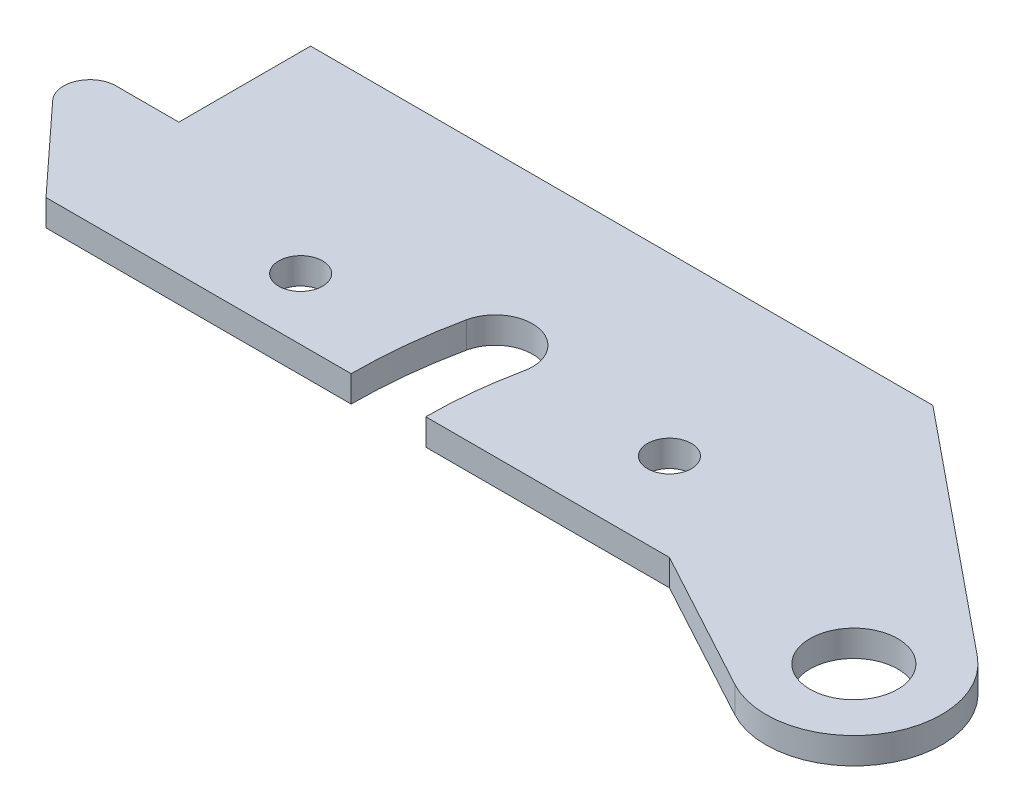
SolidWorks part; units mm, degrees
ref_plane "Front" through (0, 0, 0) normal (0, 0, 1) x (1, 0, 0)
ref_plane "Top" through (0, 0, 0) normal (0, 1, 0) x (1, 0, 0)
ref_plane "Right" through (0, 0, 0) normal (1, 0, 0) x (0, 0, -1)
sketch "Sketch1" plane through (0, 0, 0) normal (0, 1, 0) x (1, 0, 0)
  line L0 (0, 0) -> (34.75, 0)
  line L1 (43.25, 0) -> (71, 0)
  line L2 (34.75, 0) -> (43.25, 0) construction
  line L3 (0.1304, 14.9972) -> (0.1304, 30)
  line L8 (0.1304, 30) -> (71, 30)
  line L9 (71, 0) -> (87.2381, -8.7934)
  line L10 (71, 30) -> (98.315, 7.7538)
  line L11 (-6.8696, 14.9972) -> (0.1304, 14.9972)
  line L12 (0, 0) -> (-9.2038, 9.9645)
  circle A1 centre (92, 0) radius 5
  arc A2 (87.2381, -8.7934) -> (98.315, 7.7538) centre (92, 0) ccw
  arc A4 (44.3115, 10.1179) -> (35.9966, 11.8821) centre (40.1541, 11) ccw
  arc A5 (44.3115, 10.1179) -> (43.25, 0) centre (92, 0) ccw
  arc A6 (35.9966, 11.8821) -> (34.75, 0) centre (92, 0) ccw
  arc A7 (-6.8696, 14.9972) -> (-9.2038, 9.9645) centre (-7, 12) ccw
  arc A8 (48.3079, 30) -> (39, 0) centre (92, 0) ccw construction
  dimension "D2" = 39
  dimension "D4" = 7
  dimension "D6" = 53
  dimension "D7" = 10
  dimension "D8" = 10
  dimension "D9" = 30
  dimension "D10" = 4.25
  dimension "D11" = 11
  dimension "D12" = 18
  dimension "D13" = 3
  dimension "D3" = 32
  dimension "D5" = 21
extrude "Extrude1" add sketch "Sketch1" along normal blind 3
sketch "Sketch2" plane through (0, 3, 0) normal (0, 1, 0) x (1, 0, 0)
  line L0 (0, 0) -> (34.75, 0) construction
  line L1 (43.25, 0) -> (71, 0) construction
  point P0 (61, 10)
  point P1 (22, 7)
  dimension "D1" = 7
  dimension "D2" = 22
  dimension "D3" = 10
  dimension "D4" = 10
hole_wizard "M6 Tapped Hole1" positions "3DSketch1" profile "Sketch4" tap size "M6" standard "ISO"
sketch3d "3DSketch1"
  point P0 (22, 3, -7)
  point P3 (61, 3, -10)
sketch "Sketch4" plane through (22, 3, -7) normal (1, 0, 0) x (0, 0, 1)
  line L0 (0, 0) -> (0, 3)
  line L1 (0, 3) -> (2.5, 3)
  line L2 (2.5, 3) -> (2.5, 0)
  line L5 (2.5, 0) -> (0, 0)
  line L11 (0, -6.35) -> (0, 107.95) construction
  dimension "Thru Tap Drill Dia." = 5
  dimension "Thru Tap Drill Depth" = 3
